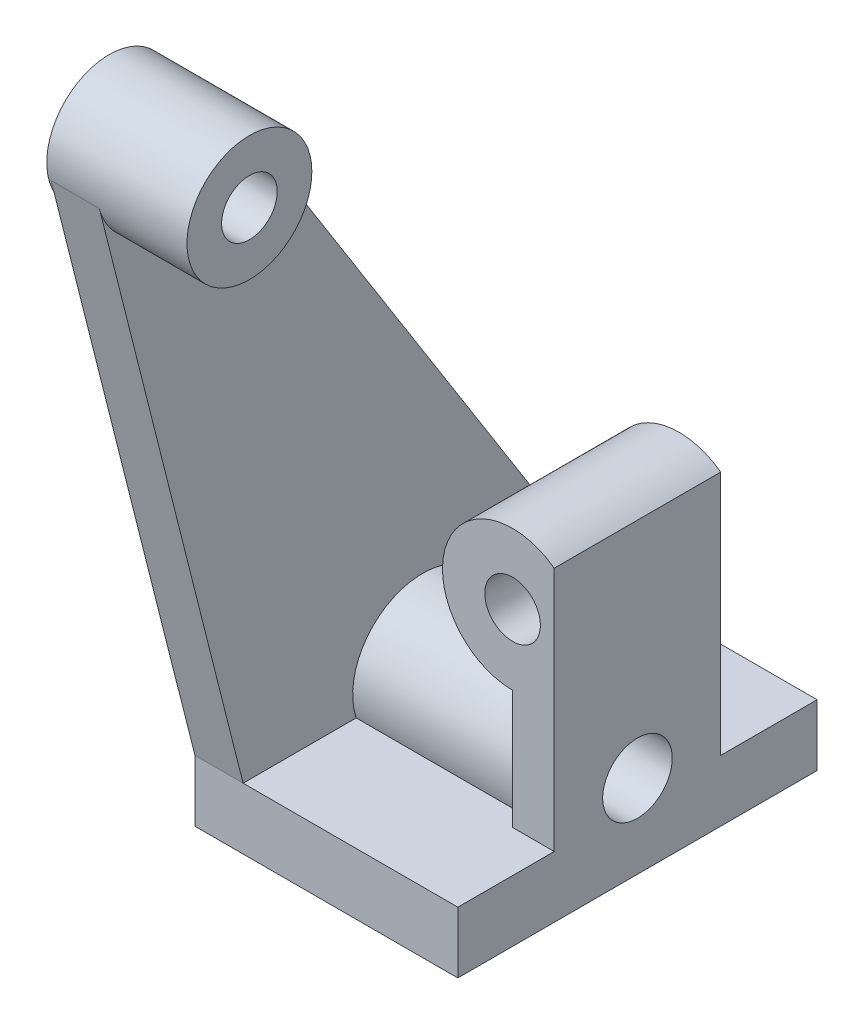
SolidWorks part; units mm, degrees
ref_plane "Front XY" through (0, 0, 0) normal (0, 0, 1) x (1, 0, 0)
ref_plane "Top XZ" through (0, 0, 0) normal (0, 1, 0) x (1, 0, 0)
ref_plane "Right YZ" through (0, 0, 0) normal (1, 0, 0) x (0, 0, -1)
sketch "Sketch1" plane through (0, 0, 0) normal (0, 1, 0) x (1, 0, 0)
  line L1 (-60, 82) -> (60, 82)
  line L2 (-60, 82) -> (-60, -82)
  line L3 (-60, -82) -> (60, -82)
  line L4 (60, 82) -> (60, -82)
  line L5 (-60, 82) -> (60, -82) construction
  line L6 (-60, -82) -> (60, 82) construction
  point P0 (0, 0)
  dimension "D1" = 120
  dimension "D2" = 164
extrude "Extrude1" add sketch "Sketch1" along normal blind 28
sketch "Sketch3" plane through (0, 0, 0) normal (0, 0, 1) x (1, 0, 0)
  line L0 (60, 0) -> (60, 139.9988)
  line L1 (41, 82.25) -> (41, 0)
  line L2 (-60, 0) -> (60, 0) construction
  line L3 (41, 0) -> (60, 0)
  arc A0 (60, 139.9988) -> (41, 82.25) centre (41, 114.25) ccw
  circle A1 centre (41, 114.25) radius 12.7
  dimension "D2" = 32
  dimension "D5" = 25.4
  dimension "D1" = 19
  dimension "D3" = 19
  dimension "D4" = 114.25
extrude "Extrude2" add sketch "Sketch3" along normal mid plane 76
sketch "Sketch2" plane through (60, 0, 0) normal (1, 0, 0) x (0, 0, -1)
  line L0 (-120, 295) -> (0, 0) construction
  circle A0 centre (-120, 295) radius 28.5
  circle A1 centre (-120, 295) radius 12.7
  dimension "D2" = 57
  dimension "D4" = 25.4
  dimension "D1" = 295
  dimension "D3" = 120
extrude "Extrude3" add sketch "Sketch2" against normal blind 64 from offset 57.12
sketch "Sketch4" plane through (-60, 0, 0) normal (-1, 0, 0) x (0, 0, 1)
  line L0 (82, 28) -> (147.6333, 288.025)
  line L1 (-82, 28) -> (95.8905, 310.198)
  line L2 (-82, 28) -> (82, 28)
  circle A0 centre (120, 295) radius 28.5 construction
  arc A1 (95.8905, 310.198) -> (147.6333, 288.025) centre (120, 295) ccw
extrude "Extrude4" add sketch "Sketch4" against normal blind 22
sketch "Sketch5" plane through (60, 0, 0) normal (1, 0, 0) x (0, 0, -1)
  line L0 (-82, 0) -> (82, 0) construction
  circle A0 centre (0, 38) radius 32
  dimension "D1" = 64
  dimension "D2" = 38
extrude "Extrude5" add sketch "Sketch5" against normal up to surface (98 mm away)
sketch "Sketch6" plane through (60, 0, 0) normal (1, 0, 0) x (0, 0, -1)
  circle A0 centre (0, 38) radius 15.875
  dimension "D1" = 31.75
extrude "Extrude6" cut sketch "Sketch6" against normal through all
sketch3d "3DSketch1"
  line L0 (-17.0705, 295, 120) -> (60, 139.9988, 28)
  line L1 (-61.12, 295, 120) -> (2.88, 295, 120) construction
  line L2 (60, 139.9988, 38) -> (60, 139.9988, -38) construction
  dimension "D1" = 10
  dimension "thickness" = 45.1835
